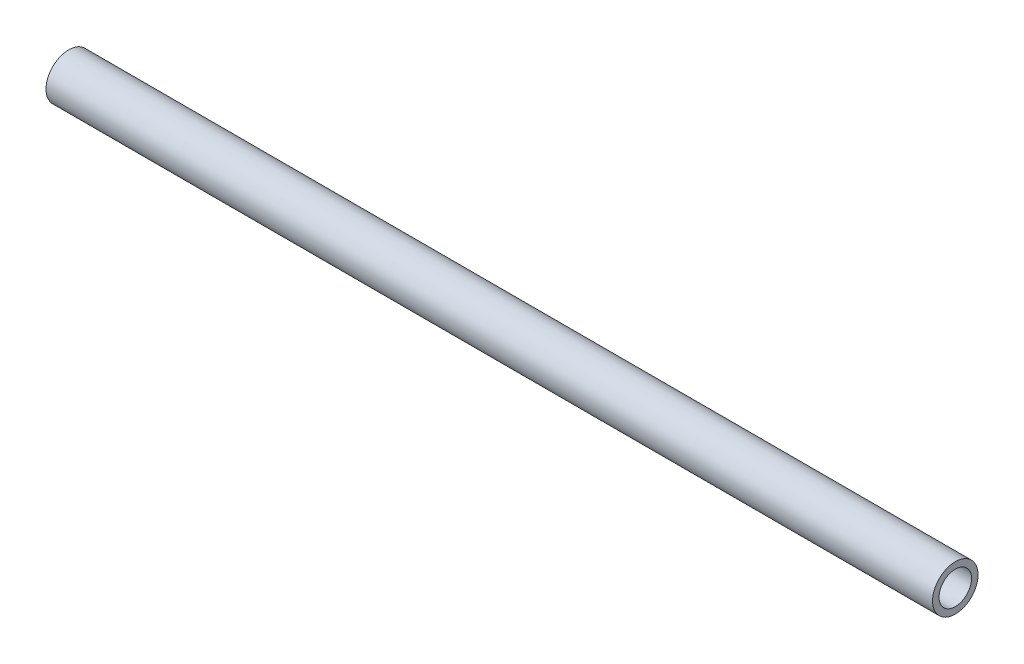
SolidWorks part; units mm, degrees
ref_plane "Front" through (0, 0, 0) normal (0, 0, 1) x (1, 0, 0)
ref_plane "Top" through (0, 0, 0) normal (0, 1, 0) x (1, 0, 0)
ref_plane "Right" through (0, 0, 0) normal (1, 0, 0) x (0, 0, -1)
sketch "Sketch1" plane through (0, 0, 0) normal (0, 0, 1) x (1, 0, 0)
  line L0 (0, 0) -> (415.925, 0)
  line L1 (9.9848, 0) -> (-9.9848, 0) construction
  dimension "D1" = 415.925
other "Structural Member1"
ref_plane "Plane1" through (0, 0, 0) normal (1, 0, 0) x (0, 0, -1)
sketch "Sketch11" plane through (0, 0, 0) normal (1, 0, 0) x (0, 0, -1)
  circle A0 centre (0, 0) radius 7.62
  circle A1 centre (0, 0) radius 10.668
  point P3 (0, 0)
  dimension "D1" = 21.336
  dimension "D2" = 15.24
